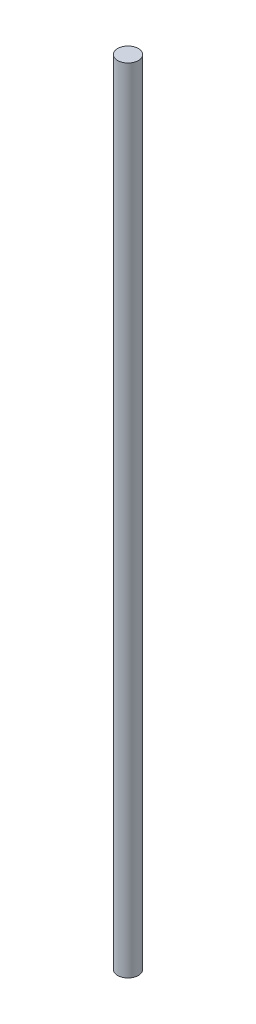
SolidWorks part; units mm, degrees
ref_plane "Front Plane" through (0, 0, 0) normal (0, 0, 1) x (1, 0, 0)
ref_plane "Top Plane" through (0, 0, 0) normal (0, 1, 0) x (1, 0, 0)
ref_plane "Right Plane" through (0, 0, 0) normal (1, 0, 0) x (0, 0, -1)
sketch "Sketch1" plane through (0, 0, 0) normal (0, 0, 1) x (1, 0, 0)
  line L0 (0, -10) -> (0, 1100) construction
  line L1 (0, 0) -> (12.5, 0)
  line L2 (12.5, 0) -> (12.5, 950)
  line L3 (12.5, 950) -> (0, 950)
  line L4 (0, 950) -> (0, 0)
revolve "Plain Central Support Pole" add sketch "Sketch1" angle 360 about L0
